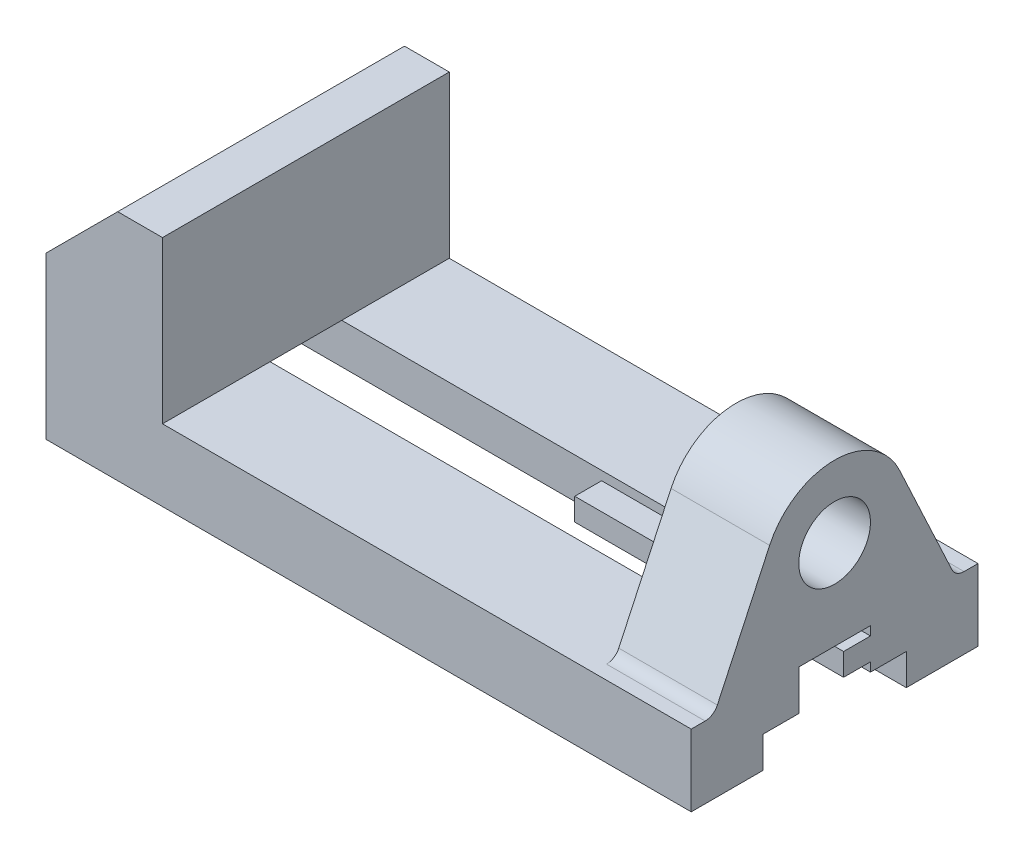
SolidWorks part; units mm, degrees
ref_plane "Front Plane" through (0, 0, 0) normal (0, 0, 1) x (1, 0, 0)
ref_plane "Top Plane" through (0, 0, 0) normal (0, 1, 0) x (1, 0, 0)
ref_plane "Right Plane" through (0, 0, 0) normal (1, 0, 0) x (0, 0, -1)
sketch "Sketch1" plane through (0, 0, 0) normal (0, 0, 1) x (1, 0, 0)
  line L0 (0, 36) -> (0, 0)
  line L1 (0, 0) -> (144, 0)
  line L2 (144, 0) -> (144, 16)
  line L3 (144, 16) -> (26, 16)
  line L4 (26, 16) -> (26, 52)
  line L5 (26, 52) -> (16, 52)
  line L6 (16, 52) -> (0, 36)
  dimension "D1" = 144
  dimension "D2" = 16
  dimension "D3" = 36
  dimension "D4" = 16
  dimension "D5" = 10
  dimension "D6" = 16
extrude "Boss-Extrude1" add sketch "Sketch1" along normal mid plane 64
sketch "Sketch2" plane through (144, 0, 0) normal (1, 0, 0) x (0, 0, -1)
  line L0 (-26.9802, 16) -> (-14.5009, 42.7619)
  line L1 (-32, 16) -> (32, 16) construction
  line L2 (26.9802, 16) -> (14.5009, 42.7619)
  line L4 (-32, 16) -> (32, 16) construction
  line L5 (-26.9802, 16) -> (26.9802, 16)
  line L6 (-32, 0) -> (32, 0) construction
  line L7 (0, 0) -> (0, 36) construction
  arc A0 (14.5009, 42.7619) -> (-14.5009, 42.7619) centre (0, 36) ccw
  circle A1 centre (0, 36) radius 8
  point P9 (0, 16)
  dimension "D1" = 16
  dimension "D4" = 16
  dimension "D2" = 36
  dimension "D3" = 50
extrude "Boss-Extrude2" add sketch "Sketch2" against normal blind 22
fillet "Fillet1" radius 3 2 edges at (133, 16, -26.9802) (133, 16, 26.9802)
sketch "Sketch3" plane through (144, 0, 0) normal (1, 0, 0) x (0, 0, -1)
  line L0 (0, 0) -> (0, 19.833) construction
  line L1 (-16, 0) -> (-16, 7)
  line L2 (-32, 0) -> (32, 0) construction
  line L3 (-16, 7) -> (-8, 7)
  line L4 (-8, 7) -> (-8, 16)
  line L5 (-8, 16) -> (8, 16)
  line L6 (8, 16) -> (8, 7)
  line L7 (8, 7) -> (16, 7)
  line L8 (16, 7) -> (16, 0)
  line L9 (16, 0) -> (-16, 0)
  dimension "D1" = 32
  dimension "D2" = 16
  dimension "D3" = 7
  dimension "D4" = 16
extrude "Cut-Extrude1" cut sketch "Sketch3" against normal through all
hole_wizard "M6x1.0 Tapped Hole1" positions "Sketch6" profile "Sketch5" tap size "M6x1.0" standard "ANSI Metric"
sketch "Sketch6" plane through (0, 0, 0) normal (0, -1, 0) x (1, 0, 0)
  line L0 (0, 0) -> (109.7104, 0) construction
  point P0 (106, -22)
  point P1 (36, -22)
  point P3 (36, 22)
  point P5 (106, 22)
  dimension "D1" = 38
  dimension "D2" = 70
  dimension "D3" = 44
sketch "Sketch5" plane through (106, 0, -22) normal (1, 0, 0) x (0, 0, -1)
  line L0 (0, 0) -> (0, 11.8026)
  line L1 (0, 11.8026) -> (3, 10)
  line L2 (3, 10) -> (3, 0)
  line L5 (3, 0) -> (0, 0)
  line L10 (0, 11.8026) -> (-3, 10) construction
  line L11 (0, -6.35) -> (0, 107.95) construction
  dimension "Tap Drill Dia." = 6
  dimension "Tap Drill Depth" = 10
  dimension "Drill Angle" = 118
sketch "Sketch7" plane through (144, 0, 0) normal (1, 0, 0) x (0, 0, -1)
  line L0 (8, 7) -> (8, 16) construction
  line L1 (2, 14) -> (8, 14)
  line L2 (2, 14) -> (2, 9)
  line L3 (2, 9) -> (8, 9)
  line L4 (8, 14) -> (8, 9)
  line L5 (16, 7) -> (8, 7) construction
  dimension "D1" = 6
  dimension "D2" = 5
  dimension "D3" = 2
extrude "Boss-Extrude3" add sketch "Sketch7" against normal blind 60
